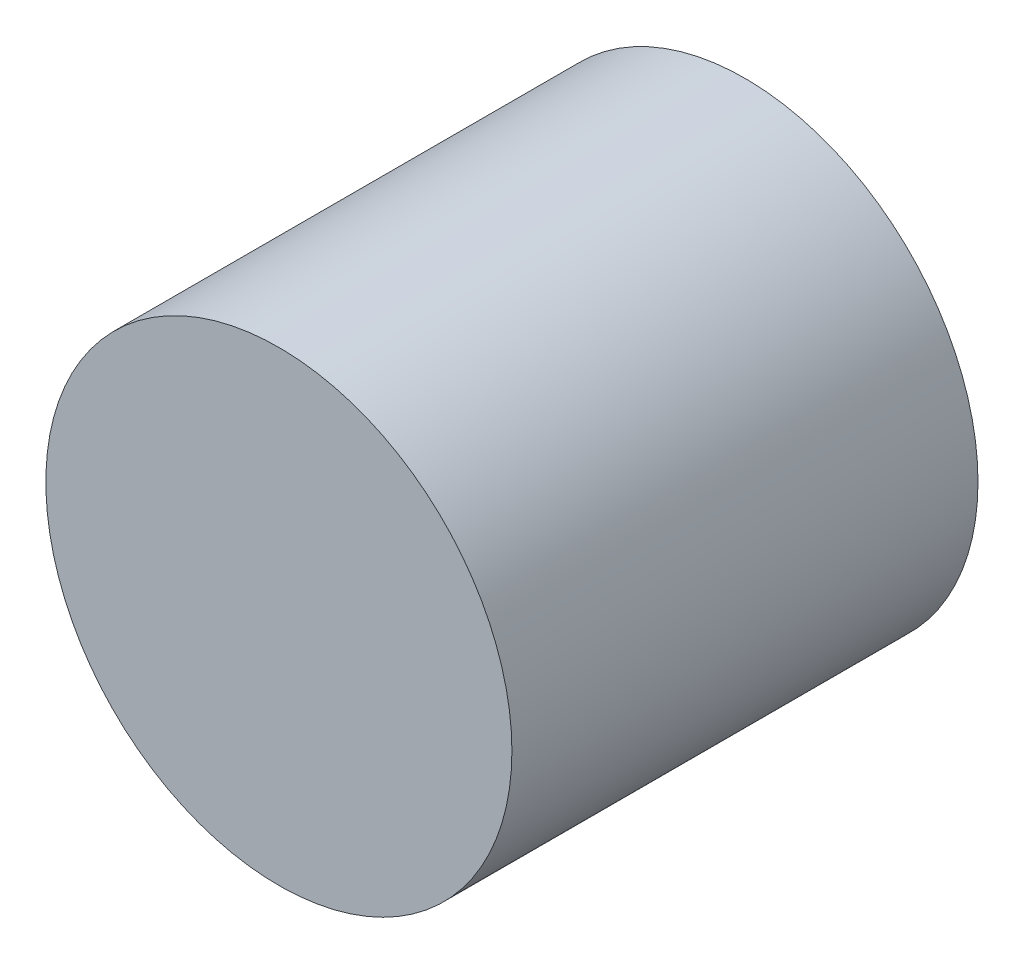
SolidWorks part; units mm, degrees
ref_plane "Plan de face" through (0, 0, 0) normal (0, 0, 1) x (1, 0, 0)
ref_plane "Plan de dessus" through (0, 0, 0) normal (0, 1, 0) x (1, 0, 0)
ref_plane "Plan de droite" through (0, 0, 0) normal (1, 0, 0) x (0, 0, -1)
sketch "Esquisse1" plane through (0, 0, 0) normal (0, 0, 1) x (1, 0, 0)
  circle A0 centre (0, 0) radius 15
  dimension "D1" = 30
extrude "Boss.-Extru.1" add sketch "Esquisse1" along normal blind 30
